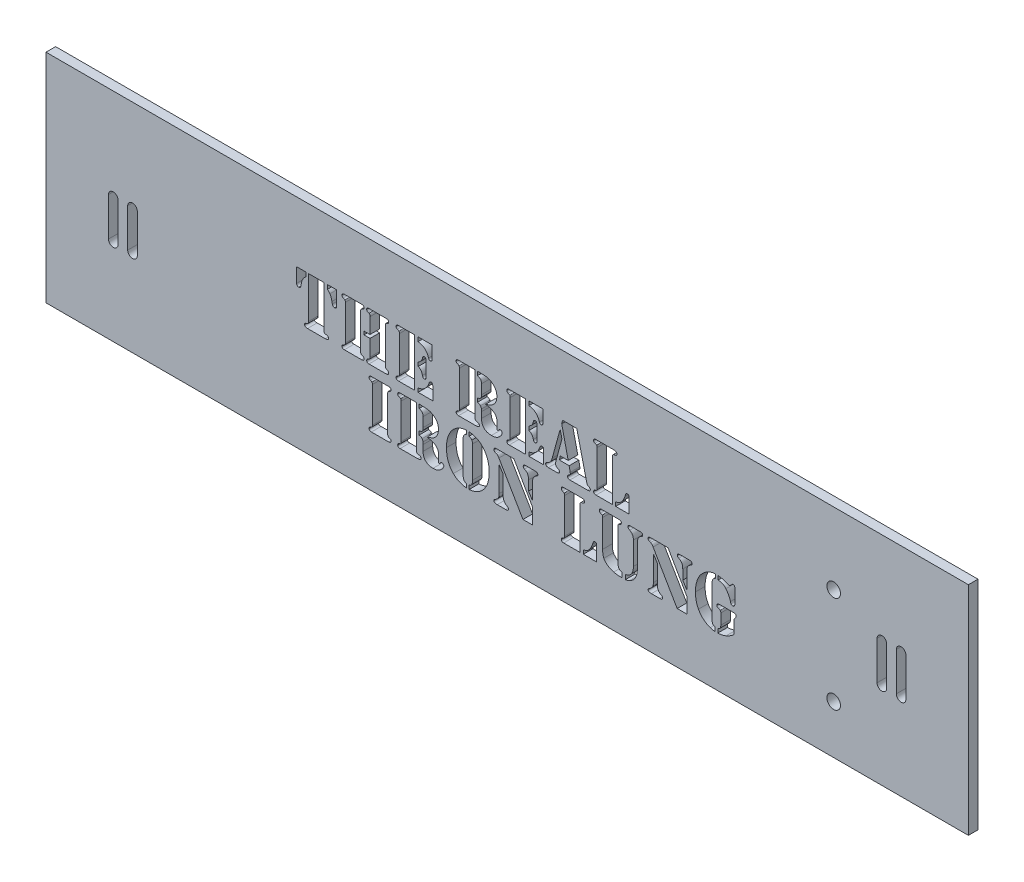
SolidWorks part; units mm, degrees
ref_plane "Front Plane" through (0, 0, 0) normal (0, 0, 1) x (1, 0, 0)
ref_plane "Top Plane" through (0, 0, 0) normal (0, 1, 0) x (1, 0, 0)
ref_plane "Right Plane" through (0, 0, 0) normal (1, 0, 0) x (0, 0, -1)
sketch "Sketch1" plane through (0, 0, 1375.4811) normal (0, 0, 1) x (1, 0, 0)
  line L0 (-894.5954, 442.1309) -> (-894.5954, 454.8309) construction
  line L1 (-897.7704, 454.8309) -> (-897.7704, 442.1309) construction
  line L2 (-900.9454, 442.1309) -> (-900.9454, 454.8309) construction
  line L3 (-904.1204, 454.8309) -> (-904.1204, 442.1309) construction
  line L4 (-650.2579, 454.8309) -> (-650.2579, 442.1309) construction
  line L5 (-647.0829, 442.1309) -> (-647.0829, 454.8309) construction
  line L6 (-643.9079, 454.8309) -> (-643.9079, 442.1309) construction
  line L7 (-640.7329, 442.1309) -> (-640.7329, 454.8309) construction
  line L8 (-620.0954, 485.2658) -> (-620.0954, 413.5559) construction
  line L9 (-620.0954, 413.5559) -> (-924.7579, 413.5559) construction
  line L10 (-620.0954, 485.2658) -> (-924.7579, 485.2658) construction
  line L11 (-924.7579, 485.2658) -> (-924.7579, 413.5559) construction
  line L12 (-894.5954, 442.1309) -> (-894.5954, 454.8309)
  line L13 (-897.7704, 454.8309) -> (-897.7704, 442.1309)
  line L14 (-900.9454, 442.1309) -> (-900.9454, 454.8309)
  line L15 (-904.1204, 454.8309) -> (-904.1204, 442.1309)
  line L16 (-650.2579, 454.8309) -> (-650.2579, 442.1309)
  line L17 (-647.0829, 442.1309) -> (-647.0829, 454.8309)
  line L18 (-643.9079, 454.8309) -> (-643.9079, 442.1309)
  line L19 (-640.7329, 442.1309) -> (-640.7329, 454.8309)
  line L20 (-620.0954, 485.2658) -> (-620.0954, 413.5559)
  line L21 (-620.0954, 413.5559) -> (-924.7579, 413.5559)
  line L22 (-620.0954, 485.2658) -> (-924.7579, 485.2658)
  line L23 (-924.7579, 485.2658) -> (-924.7579, 413.5559)
  arc A0 (-894.5954, 454.8309) -> (-897.7704, 454.8309) centre (-896.1829, 454.8309) ccw construction
  arc A1 (-897.7704, 442.1309) -> (-894.5954, 442.1309) centre (-896.1829, 442.1309) ccw construction
  arc A2 (-904.1204, 442.1309) -> (-900.9454, 442.1309) centre (-902.5329, 442.1309) ccw construction
  arc A3 (-900.9454, 454.8309) -> (-904.1204, 454.8309) centre (-902.5329, 454.8309) ccw construction
  arc A4 (-647.0829, 454.8309) -> (-650.2579, 454.8309) centre (-648.6704, 454.8309) ccw construction
  arc A5 (-650.2579, 442.1309) -> (-647.0829, 442.1309) centre (-648.6704, 442.1309) ccw construction
  arc A6 (-643.9079, 442.1309) -> (-640.7329, 442.1309) centre (-642.3204, 442.1309) ccw construction
  arc A7 (-640.7329, 454.8309) -> (-643.9079, 454.8309) centre (-642.3204, 454.8309) ccw construction
  arc A8 (-894.5954, 454.8309) -> (-897.7704, 454.8309) centre (-896.1829, 454.8309) ccw
  arc A9 (-897.7704, 442.1309) -> (-894.5954, 442.1309) centre (-896.1829, 442.1309) ccw
  arc A10 (-904.1204, 442.1309) -> (-900.9454, 442.1309) centre (-902.5329, 442.1309) ccw
  arc A11 (-900.9454, 454.8309) -> (-904.1204, 454.8309) centre (-902.5329, 454.8309) ccw
  arc A12 (-647.0829, 454.8309) -> (-650.2579, 454.8309) centre (-648.6704, 454.8309) ccw
  arc A13 (-650.2579, 442.1309) -> (-647.0829, 442.1309) centre (-648.6704, 442.1309) ccw
  arc A14 (-643.9079, 442.1309) -> (-640.7329, 442.1309) centre (-642.3204, 442.1309) ccw
  arc A15 (-640.7329, 454.8309) -> (-643.9079, 454.8309) centre (-642.3204, 454.8309) ccw
extrude "Boss-Extrude1" add sketch "Sketch1" along normal blind 3.175
sketch "Sketch2" plane through (0, 0, 1378.6561) normal (0, 0, 1) x (1, 0, 0)
  line L0 (-924.7579, 449.4108) -> (-620.0954, 449.4108) construction
  line L1 (-924.7579, 485.2658) -> (-924.7579, 413.5559) construction
  line L2 (-620.0954, 413.5559) -> (-620.0954, 485.2658) construction
  line L3 (-924.7579, 430.3608) -> (-620.0954, 430.3608) construction
  text T0 "     IRON LUNG" font "Stencil" height 15.875
  text T1 "THE REAL     " font "Stencil" height 15.875
  dimension "D1" = 19.05
extrude "Cut-Extrude1" cut sketch "Sketch2" against normal blind 3.175
sketch "Sketch3" plane through (0, 0, 1378.6561) normal (0, 0, 1) x (1, 0, 0)
  circle A2 centre (-664.5954, 461.5809) radius 2.25
  circle A3 centre (-664.5954, 429.5809) radius 2.25
  dimension "D1" = 4.5
  dimension "D2" = 4.5
extrude "Cut-Extrude2" cut sketch "Sketch3" against normal through all
